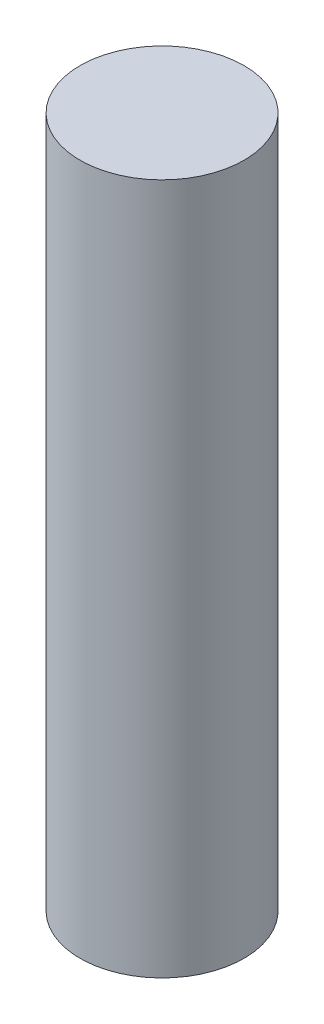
SolidWorks part; units mm, degrees
ref_plane "Alzado" through (0, 0, 0) normal (0, 0, 1) x (1, 0, 0)
ref_plane "Planta" through (0, 0, 0) normal (0, 1, 0) x (1, 0, 0)
ref_plane "Vista lateral" through (0, 0, 0) normal (1, 0, 0) x (0, 0, -1)
sketch "Croquis3" plane through (0, 0, 0) normal (0, 0, 1) x (1, 0, 0)
  line L0 (0, 0) -> (0, 12.64) construction
  line L1 (0, 12.64) -> (1.5, 12.64)
  line L2 (1.5, 12.64) -> (1.5, 0)
  line L3 (1.5, 0) -> (0, 0)
  line L4 (0, 0) -> (0, 12.64)
  dimension "D1" = 12.64
  dimension "D2" = 1.5
revolve "Revolución2" add sketch "Croquis3" angle 360 about L0
